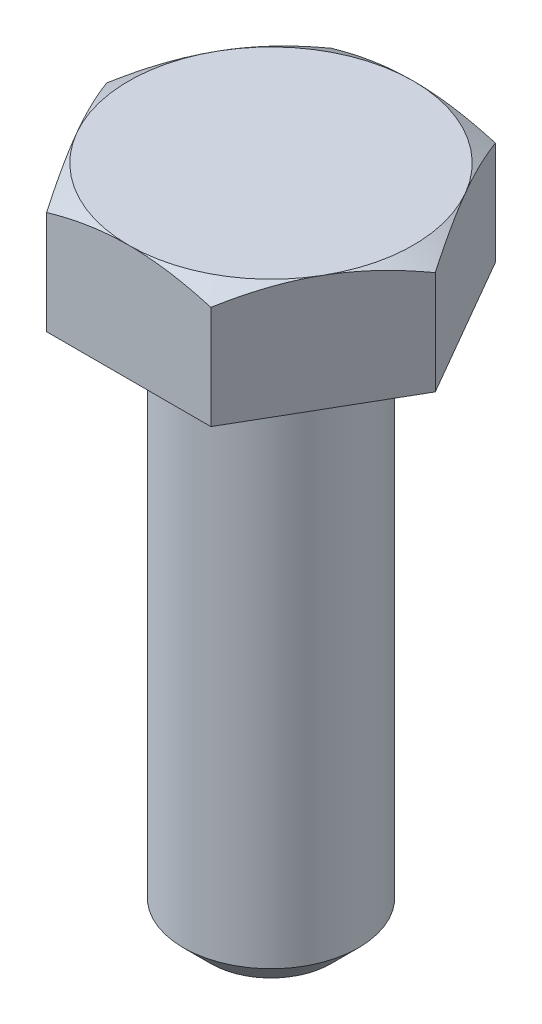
SolidWorks part; units mm, degrees
extrude "Base-Extrusion" add sketch "Esquisse2" against normal blind 25
sketch "Esquisse2" plane through (0, 0, 0) normal (0, 1, 0) x (1, 0, 0)
  circle A0 centre (0, 0) radius 4
  dimension "Diamètre nominal" = 8
chamfer "Chanfrein1" distance 1.4521 angle 45
ref_plane "Plan1" through (0, 0, 0) normal (0, 0, 1) x (1, 0, 0)
ref_plane "Plan2" through (0, 0, 0) normal (0, 1, 0) x (1, 0, 0)
ref_plane "Plan3" through (0, 0, 0) normal (1, 0, 0) x (0, 0, -1)
sketch "Esquisse5" plane through (0, 0, 0) normal (0, 0, 1) x (1, 0, 0)
  line L0 (-6.5, 0) -> (6.5, 0) construction
  line L1 (0, 0) -> (9.1924, 0)
  line L2 (0, 0) -> (0, 5.3)
  line L3 (0, 5.3) -> (6.5, 5.3)
  line L5 (9.1924, 0) -> (9.1924, 3.7455)
  line L6 (6.5, 5.3) -> (9.1924, 3.7455)
  line L7 (0, 5.3) -> (0, -25) construction
  line L8 (0, -23.75) -> (0, 0) construction
  line L9 (-2.75, -25) -> (2.75, -25) construction
revolve "Boss.-Révol.1" add sketch "Esquisse5" angle 360 about L7
sketch "Esquisse6" plane through (0, 0, 0) normal (0, -1, 0) x (1, 0, 0)
  line L0 (7.5056, 0) -> (-6.5, 0) construction
  line L1 (0, 0) -> (4.5962, -7.9608) construction
  line L2 (0, 0) -> (7.9608, -4.5962) construction
  line L3 (0, 0) -> (0, -6.5) construction
  line L4 (-3.7528, -6.5) -> (3.7528, -6.5)
  line L5 (3.7528, -6.5) -> (7.5056, 0)
  line L6 (-3.7528, 6.5) -> (3.7528, 6.5)
  line L7 (3.7528, 6.5) -> (7.5056, 0)
  line L8 (-3.7528, -6.5) -> (-7.5056, 0)
  line L9 (-3.7528, 6.5) -> (-7.5056, 0)
  circle A0 centre (0, 0) radius 9.1924 construction
  circle A3 centre (0, 0) radius 6.5 construction
  point P17 (0, 6.5)
  dimension "D1" = 30
  dimension "D2" = 30
extrude "Enlèv. mat.-Extru.1" cut sketch "Esquisse6" against normal blind 5.3 flip side to cut
sketch "Esquisse3" plane through (0, -25, 0) normal (0, -1, 0) x (1, 0, 0)
  circle A0 centre (0, 0) radius 4
  circle A1 centre (0, 0) radius 4 construction
equation "\"D4@Esquisse5\" = \"Cote sur plats@Esquisse5\"/2"
equation "\"D1@Esquisse5\" =(\"D4@Esquisse5\"*sqr(2)*2)/2"
